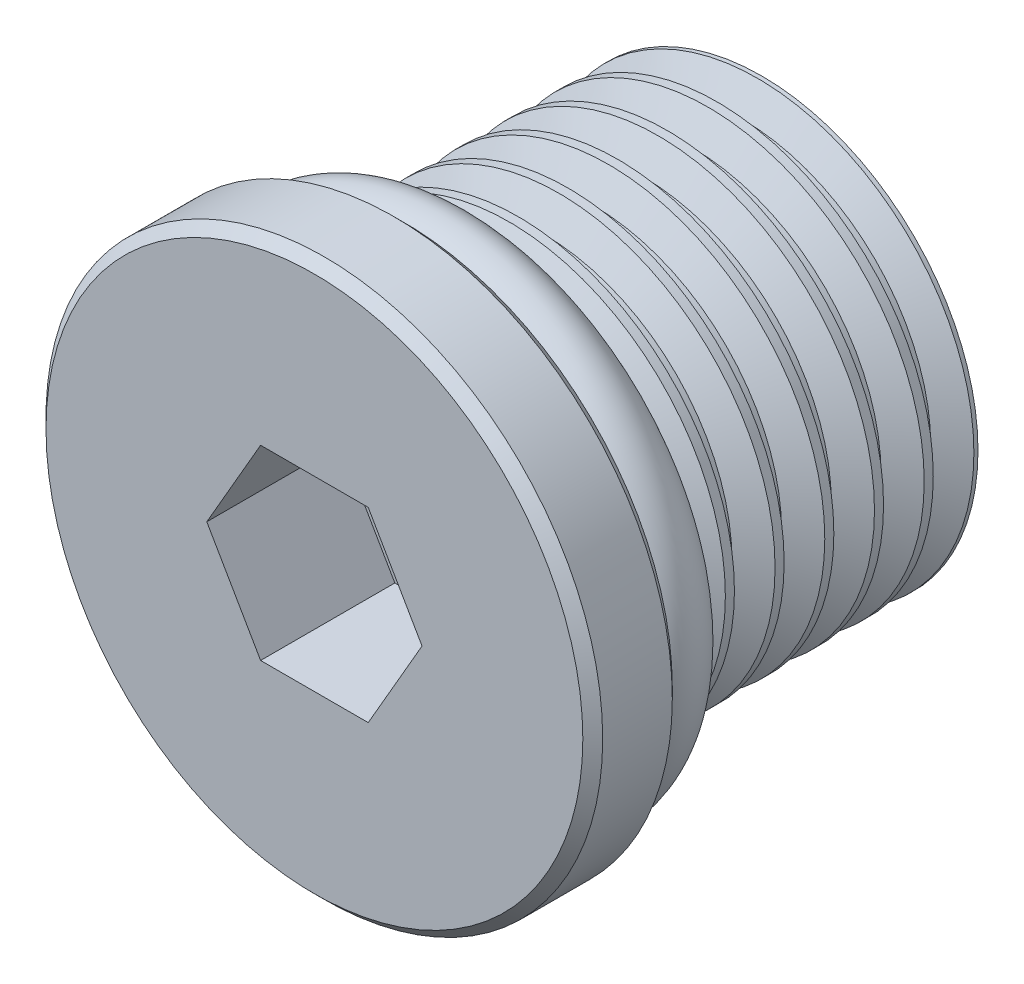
SolidWorks part; units mm, degrees
ref_plane "Front" through (0, 0, 0) normal (0, 0, 1) x (1, 0, 0)
ref_plane "Top" through (0, 0, 0) normal (0, 1, 0) x (1, 0, 0)
ref_plane "Right" through (0, 0, 0) normal (1, 0, 0) x (0, 0, -1)
sketch "Sketch1" plane through (0, 0, 0) normal (0, 0, 1) x (1, 0, 0)
  circle A0 centre (0, 0) radius 7.112
  dimension "D1" = 14.224
extrude "Base-Extrude" add sketch "Sketch1" against normal blind 2.286
sketch "Sketch2" plane through (0, 0, -2.286) normal (0, 0, -1) x (-1, 0, 0)
  circle A0 centre (0, 0) radius 4.826
  dimension "D1" = 9.652
extrude "Boss-Extrude1" add sketch "Sketch2" along normal blind 2.286
sketch "Sketch3" plane through (0, 0, 0) normal (1, 0, 0) x (0, 0, -1)
  line L0 (4.572, 4.826) -> (4.9753, 5.5245)
  line L1 (4.9753, 5.5245) -> (5.207, 5.5245)
  line L2 (5.207, 5.5245) -> (5.6103, 4.826)
  line L3 (4.572, -4.826) -> (4.572, 4.826) construction
  line L4 (-1.0412, 0) -> (11.8893, 0) construction
  line L5 (2.286, 0) -> (0, 0) construction
  line L6 (4.572, 4.826) -> (2.286, 4.826) construction
  line L7 (5.6103, 4.826) -> (5.842, 4.826)
  line L8 (5.842, 4.826) -> (6.2453, 5.5245)
  line L9 (6.2453, 5.5245) -> (6.477, 5.5245)
  line L10 (6.477, 5.5245) -> (6.8803, 4.826)
  line L11 (6.8803, 4.826) -> (7.112, 4.826)
  line L12 (7.112, 4.826) -> (7.5153, 5.5245)
  line L13 (7.5153, 5.5245) -> (7.747, 5.5245)
  line L14 (7.747, 5.5245) -> (8.1503, 4.826)
  line L15 (8.1503, 4.826) -> (8.382, 4.826)
  line L16 (8.382, 4.826) -> (8.7853, 5.5245)
  line L17 (8.7853, 5.5245) -> (9.017, 5.5245)
  line L18 (9.017, 5.5245) -> (9.4203, 4.826)
  line L19 (9.4203, 4.826) -> (9.652, 4.826)
  line L20 (9.652, 4.826) -> (10.0553, 5.5245)
  line L21 (10.0553, 5.5245) -> (10.287, 5.5245)
  line L22 (10.287, 5.5245) -> (10.6903, 4.826)
  line L23 (10.6903, 4.826) -> (10.922, 4.826)
  line L24 (12.192, 4.826) -> (12.192, 0)
  line L25 (4.572, 4.826) -> (4.572, 0)
  line L26 (12.192, 0) -> (4.572, 0)
  line L27 (10.922, 4.826) -> (11.3253, 5.5245)
  line L28 (11.3253, 5.5245) -> (11.557, 5.5245)
  line L29 (11.557, 5.5245) -> (11.9603, 4.826)
  line L30 (11.9603, 4.826) -> (12.192, 4.826)
  dimension "D1" = 150
  dimension "D2" = 120
  dimension "D3" = 11.049
  dimension "D4" = 1.27
revolve "Boss-Revolve1" add sketch "Sketch3" angle 360 about L4
sketch "Sketch4" plane through (0, 0, 0) normal (1, 0, 0) x (0, 0, -1)
  line L0 (11.43, 7.1329) -> (11.43, -7.0439)
  line L1 (12.192, -4.826) -> (12.192, 4.826) construction
  dimension "D1" = 0.762
extrude "Cut-Extrude1" cut sketch "Sketch4" against normal through all and the other way through all
chamfer "Chamfer2" distance 0.254 angle 45
sketch "Sketch5" plane through (0, 0, 0) normal (0, 0, 1) x (1, 0, 0)
  line L1 (2.7496, 0) -> (1.3748, 2.3813)
  line L2 (1.3748, 2.3813) -> (-1.3748, 2.3813)
  line L3 (-1.3748, 2.3813) -> (-2.7496, 0)
  line L4 (-2.7496, 0) -> (-1.3748, -2.3813)
  line L5 (-1.3748, -2.3813) -> (1.3748, -2.3813)
  line L6 (1.3748, -2.3813) -> (2.7496, 0)
  circle A0 centre (0, 0) radius 2.3813 construction
extrude "Cut-Extrude2" cut sketch "Sketch5" against normal blind 3.429
sketch "Sketch6" plane through (0, 0, 0) normal (1, 0, 0) x (0, 0, -1)
  line L0 (4.572, 4.826) -> (2.286, 4.826) construction
  line L1 (4.572, 4.826) -> (2.286, 4.826) construction
  line L2 (2.286, -6.858) -> (2.286, 6.858) construction
  line L3 (2.286, -6.858) -> (2.286, 6.858) construction
  line L4 (-0.906, 0) -> (13.4265, 0) construction
  line L5 (2.032, 0) -> (0.254, 0) construction
  circle A0 centre (3.175, 5.715) radius 0.9144
  dimension "D2" = 0.0254
  dimension "D3" = 1.8288
  dimension "D1" = 0.0254
revolve "Boss-Revolve2" add sketch "Sketch6" angle 360 about L4
